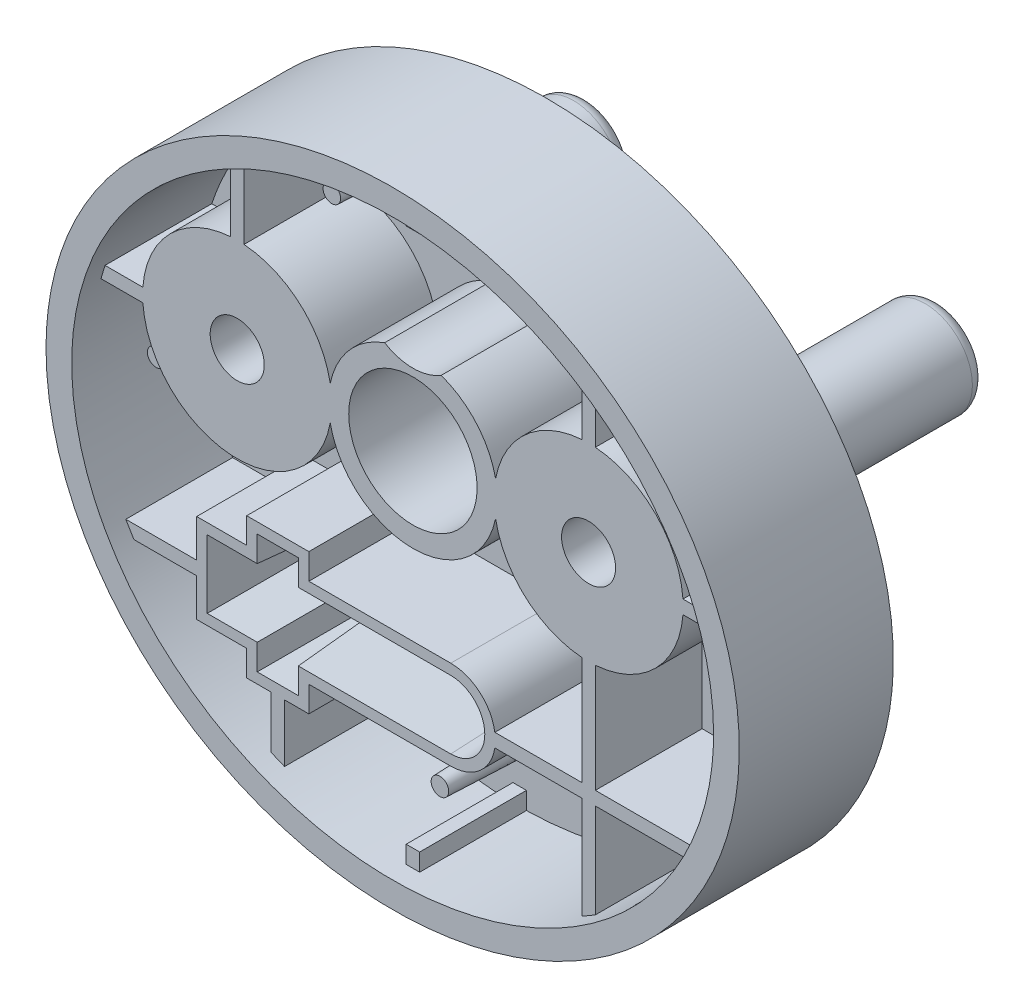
SolidWorks part; units mm, degrees
ref_plane "Face" through (0, 0, 0) normal (0, 0, 1) x (1, 0, 0)
ref_plane "Dessus" through (0, 0, 0) normal (0, 1, 0) x (1, 0, 0)
ref_plane "Droite" through (0, 0, 0) normal (1, 0, 0) x (0, 0, -1)
sketch "Esquisse1" plane through (0, 0, 0) normal (0, 0, 1) x (1, 0, 0)
  ellipse E0 centre (0, 0) end of major axis (-25.65, 0) minor radius 23.15
  spline S2 degree 3 poles (23.75, 0) (23.75, 2.7816) (23.1319, 5.5621) (20.7524, 10.7019) (18.9921, 13.0591) (14.5955, 16.9929) (11.961, 18.568) (6.2165, 20.6969) (3.1089, 21.25) (-3.1089, 21.25) (-6.2165, 20.6969) (-11.961, 18.568) (-14.5955, 16.9929) (-18.9921, 13.0591) (-20.7524, 10.7019) (-23.1319, 5.5621) (-23.75, 2.7816) (-23.75, 0) (-23.75, -2.7816) (-23.1319, -5.5621) (-20.7524, -10.7019) (-18.9921, -13.0591) (-14.5955, -16.9929) (-11.961, -18.568) (-6.2165, -20.6969) (-3.1089, -21.25) (3.1089, -21.25) (6.2165, -20.6969) (11.961, -18.568) (14.5955, -16.9929) (18.9921, -13.0591) (20.7524, -10.7019) (23.1319, -5.5621) (23.75, -2.7816) (23.75, 0) (23.75, 2.7816) (23.1319, 5.5621) knots 2.748894 3.141593 3.141593 3.141593 3.534292 3.534292 3.926991 3.926991 4.31969 4.31969 4.712389 4.712389 5.105088 5.105088 5.497787 5.497787 5.890486 5.890486 6.283185 6.283185 6.283185 6.675884 6.675884 7.068583 7.068583 7.461283 7.461283 7.853982 7.853982 8.246681 8.246681 8.63938 8.63938 9.032079 9.032079 9.424778 9.424778 9.424778 9.817477 9.817477 10.210176 only from (23.75, 0) to (23.75, 0)
  dimension "D2" = 46.3
  dimension "D3" = 51.3
extrude "corps1" add sketch "Esquisse1" against normal blind 11.4
sketch "Esquisse2" plane through (0, 0, -11.4) normal (0, 0, -1) x (-1, 0, 0)
  ellipse E0 centre (0, 0) end of major axis (25.65, 0) minor radius 23.15 construction
  ellipse E1 centre (0, 0) end of major axis (25.65, 0) minor radius 23.15
extrude "corps2" add sketch "Esquisse2" against normal blind 2
sketch "Esquisse3" plane through (0, 0, -7.5) normal (0, 0, -1) x (-1, 0, 0)
  circle A0 centre (21, 0) radius 0.7905 construction
  circle A1 centre (21, 0) radius 0.7905
  circle A2 centre (8, 17) radius 0.7905 construction
  circle A3 centre (8, 17) radius 0.7905
  circle A4 centre (0, -17) radius 0.7905 construction
  circle A5 centre (0, -17) radius 0.7905
  circle A6 centre (-8, 17) radius 0.7905 construction
  circle A7 centre (-8, 17) radius 0.7905
  circle A8 centre (-21, 0) radius 0.7905 construction
  circle A9 centre (-21, 0) radius 0.7905
extrude "assemblage couvercle" add sketch "Esquisse3" along normal up to next (1.9 mm away) draft 2 and the other way blind 4 draft 2
ref_plane "Plan1" through (0, -9, 0) normal (0, 1, 0) x (-1, 0, 0)
sketch "Esquisse4" plane through (-3.1794, 17.515, -9.4) normal (0, 0, 1) x (1, 0, 0)
  line L5 (-22.4706, -27.515) -> (16.5562, -27.515) construction
  line L12 (-12.8206, -24.215) -> (-9.1206, -24.215)
  line L13 (-9.1206, -24.215) -> (-9.1206, -22.315)
  line L14 (-9.1206, -22.315) -> (-4.5206, -22.315)
  line L15 (-4.5206, -22.315) -> (-4.5206, -24.215)
  line L16 (-4.5206, -24.215) -> (5.9794, -24.215)
  line L17 (-4.5206, -30.815) -> (5.9794, -30.815)
  line L18 (-4.5206, -32.715) -> (-4.5206, -30.815)
  line L19 (-9.1206, -32.715) -> (-4.5206, -32.715)
  line L20 (-9.1206, -30.815) -> (-9.1206, -32.715)
  line L21 (-12.8206, -30.815) -> (-9.1206, -30.815)
  line L22 (-12.8206, -24.215) -> (-12.8206, -30.815)
  arc A1 (5.9794, -24.215) -> (5.9794, -30.815) centre (5.9794, -27.515) cw
  point P0 (-10.7206, -24.515)
  point P6 (7.2794, -24.515)
  point P8 (6.7794, -26.515)
  point P9 (-10.7206, -28.515)
  point P11 (7.2794, -28.515)
  dimension "D7" = 4.6
  dimension "D3" = 10.4
  dimension "D6" = 8.3
  dimension "D1" = 6.6
  dimension "D2" = 3.3
  dimension "D4" = 5.2
  dimension "D5" = 18.8
  dimension "D8" = 4.6
  dimension "D9" = 8.3
  dimension "D10" = 12.3
  dimension "D11" = 10
extrude "passage outil" add sketch "Esquisse4" along normal blind 7.9
ref_plane "Plan2" through (0, 5.5, 0) normal (0, 1, 0) x (-1, 0, 0)
sketch "Esquisse5" plane through (0, 5.5, 0) normal (0, 1, 0) x (-1, 0, 0)
  line L0 (13, -0.0874) -> (13, -22.5845) construction
  line L1 (15, -1.5) -> (20, -1.5)
  line L2 (20, -1.5) -> (20, -11.4)
  line L3 (20, -11.4) -> (19, -11.4)
  line L4 (19, -11.4) -> (19, -2.5)
  line L5 (19, -2.5) -> (16.5, -2.5)
  line L6 (16.5, -2.5) -> (16.5, -27.4)
  line L7 (16.5, -27.4) -> (15, -27.4)
  line L8 (15, -27.4) -> (15, -1.5)
  line L10 (-23.6976, -1.5) -> (23.6976, -1.5) construction
  line L11 (-25.65, -11.4) -> (25.65, -11.4) construction
  line L12 (0, 6.27) -> (0, -6.27) construction
  dimension "D1" = 7
  dimension "EP" = 1
  dimension "D2" = 7
  dimension "D5" = 2
  dimension "D3" = 16
  dimension "D4" = 13
  dimension "D6" = 1
revolve "MIP BOITIER 1" add sketch "Esquisse5" angle 360 about L0
sketch "Esquisse14" plane through (0, 0, -11.4) normal (0, 0, -1) x (-1, 0, 0)
  circle A0 centre (13, 5.5) radius 3.5 construction
  circle A1 centre (13, 5.5) radius 3.5
  circle A2 centre (13, 5.5) radius 6
  dimension "D1" = 12
extrude "Enlèv. mat.-Extru.6" cut sketch "Esquisse14" against normal blind 3
fillet "Congé1" radius 1 1 edges at (-9.5, 5.5, -27.4)
sketch "Esquisse15" plane through (0, 0, -11.4) normal (0, 0, -1) x (-1, 0, 0)
  circle A0 centre (13, 5.5) radius 2 construction
  circle A1 centre (13, 5.5) radius 2
extrude "Enlèv. mat.-Extru.7" cut sketch "Esquisse15" against normal blind 3
mirror "Symétrie MIP BOITIER" about plane through (0, 0, 0) normal (1, 0, 0) of "Enlèv. mat.-Extru.7", "MIP BOITIER 1", "Enlèv. mat.-Extru.6", "Congé1"
sketch "Esquisse7" plane through (0, 0, -9.4) normal (0, 0, 1) x (1, 0, 0)
  line L0 (5.985, 5.5) -> (-5.985, 5.5) construction
  line L1 (0, -15.07) -> (0, 15.07) construction
  circle A0 centre (0, 5.5) radius 4.75
  circle A1 centre (0, 5.5) radius 6.25
  dimension "D1" = 9.5
  dimension "D2" = 1.5
extrude "PASSAGE BUTEE" add sketch "Esquisse7" along normal up to surface (7.9 mm away)
sketch "Esquisse9" plane through (0, 0, -9.4) normal (0, 0, 1) x (1, 0, 0)
  circle A0 centre (0, 5.5) radius 4.75 construction
  circle A1 centre (0, 5.5) radius 4.75
extrude "Enlèv. mat.-Extru.3" cut sketch "Esquisse9" against normal through all
sketch "Esquisse10" plane through (0, 0, -9.4) normal (0, 0, 1) x (1, 0, 0)
  line L0 (0, -6.27) -> (0, 6.27) construction
  circle A0 centre (0, 14.8) radius 3.25
  circle A1 centre (0, 5.5) radius 6.25 construction
  dimension "D1" = 9.3
  dimension "D2" = 6.5
extrude "PASSAGE CENTRE RESSORT" cut sketch "Esquisse10" against normal through all
sketch "Esquisse11" plane through (0, 0, -9.4) normal (0, 0, 1) x (1, 0, 0)
  circle A0 centre (0, 14.8) radius 4
  circle A1 centre (0, 14.8) radius 3.25 construction
  dimension "D1" = 8
extrude "Enlèv. mat.-Extru.5" cut sketch "Esquisse11" along normal blind 17
sketch "Esquisse13" plane through (0, 0, -11.4) normal (0, 0, -1) x (-1, 0, 0)
  line L0 (-4.75, 14.8) -> (-3.75, 14.8)
  line L1 (3.75, 14.8) -> (4.75, 14.8)
  arc A1 (-4.75, 14.8) -> (4.75, 14.8) centre (0, 14.8) ccw
  arc A3 (-3.75, 14.8) -> (3.75, 14.8) centre (0, 14.8) ccw
  dimension "D1" = 1
  dimension "D2" = 3.75
extrude "Extrusion3" add sketch "Esquisse13" along normal blind 4.5
sketch "Esquisse16" plane through (0, 0, -11.4) normal (0, 0, -1) x (-1, 0, 0)
  ellipse E1 centre (0, 0) end of major axis (25.65, 0) minor radius 23.15
  ellipse E2 centre (0, 0) end of major axis (25.65, 0) minor radius 23.15
  dimension "D1" = 0
sketch "Esquisse17" plane through (0, 0, -11.4) normal (0, 0, -1) x (-1, 0, 0)
  line L22 (9, -8) -> (-2.8, -8)
  line L23 (-2.8, -12) -> (9, -12)
  line L24 (9, -12) -> (9, -13.9)
  line L25 (9, -13.9) -> (11, -13.9)
  line L26 (11, -13.9) -> (11, -12)
  line L27 (11, -12) -> (14.7, -12)
  line L28 (14.7, -12) -> (14.7, -8)
  line L29 (14.7, -8) -> (11, -8)
  line L30 (11, -8) -> (11, -6.1)
  line L31 (11, -6.1) -> (9, -6.1)
  line L32 (9, -6.1) -> (9, -8)
  arc A2 (-2.8, -8) -> (-2.8, -12) centre (-2.8, -10) ccw
  dimension "D1" = 14.7
  dimension "D2" = 3.7
  dimension "D3" = 2
  dimension "D4" = 8
  dimension "D5" = 4
  dimension "D6" = 2.8
extrude "Enlèv. mat.-Extru.8" cut sketch "Esquisse17" against normal through all draft 3
sketch "Esquisse18" plane through (0, 0, -1.5) normal (0, 0, 1) x (1, 0, 0)
  line L1 (-16, -10) -> (-22.3062, -10)
  line L2 (-16, -6.7) -> (-16, -13.3) construction
extrude "Extru.-Mince1" add sketch "Esquisse18" against normal up to next thin
sketch "Esquisse19" plane through (0, 0, -1.5) normal (0, 0, 1) x (1, 0, 0)
  line L0 (5.3188, -10) -> (21.7588, -10)
  arc A0 (2.8, -12.5188) -> (2.8, -7.4812) centre (2.8, -10) ccw construction
extrude "Extru.-Mince2" add sketch "Esquisse19" against normal up to next thin
sketch "Esquisse20" plane through (0, 0, -1.5) normal (0, 0, 1) x (1, 0, 0)
  line L0 (-19.5612, 5.5) -> (-23.9112, 5.5)
extrude "Extru.-Mince3" add sketch "Esquisse20" against normal up to next thin
sketch "Esquisse21" plane through (0, 0, -1.5) normal (0, 0, 1) x (1, 0, 0)
  line L0 (19.6444, 5.5) -> (23.4771, 5.5)
extrude "Extru.-Mince4" add sketch "Esquisse21" against normal up to next thin
sketch "Esquisse22" plane through (0, 0, -1.5) normal (0, 0, 1) x (1, 0, 0)
  line L0 (13, -1.1394) -> (13, -18.3866)
extrude "Extru.-Mince5" add sketch "Esquisse22" against normal up to next thin
sketch "Esquisse23" plane through (0, 0, -1.5) normal (0, 0, 1) x (1, 0, 0)
  line L0 (13, 12.1404) -> (13, 18.569)
extrude "Extru.-Mince6" add sketch "Esquisse23" against normal up to next thin
sketch "Esquisse24" plane through (0, 0, -1.5) normal (0, 0, 1) x (1, 0, 0)
  line L0 (-13, 12.2303) -> (-13, 18.7027)
extrude "Extru.-Mince7" add sketch "Esquisse24" against normal up to next thin
sketch "Esquisse25" plane through (0, 0, -1.5) normal (0, 0, 1) x (1, 0, 0)
  line L0 (-10, -15.2) -> (-10, -19.6278)
  line L1 (-12.3, -15.2) -> (-7.7, -15.2) construction
extrude "Extru.-Mince8" add sketch "Esquisse25" against normal up to next thin
sketch "Esquisse26" plane through (0, 0, -1.5) normal (0, 0, 1) x (1, 0, 0)
  line L1 (-0.5, 21.712) -> (0.5, 21.712)
  line L2 (-0.5, 21.712) -> (-0.5, 19.6657)
  line L3 (-0.5, 19.6657) -> (0.5, 19.6657)
  line L4 (0.5, 21.712) -> (0.5, 19.6657)
  line L5 (-0.5, -21.5187) -> (0.5, -21.5187)
  line L6 (-0.5, -21.5187) -> (-0.5, -19.9504)
  line L7 (-0.5, -19.9504) -> (0.5, -19.9504)
  line L8 (0.5, -21.5187) -> (0.5, -19.9504)
  dimension "D1" = 1
  dimension "D2" = 0.5
  dimension "D3" = 1
  dimension "D4" = 0.5
extrude "Boss.-Extru.1" add sketch "Esquisse26" against normal up to next
